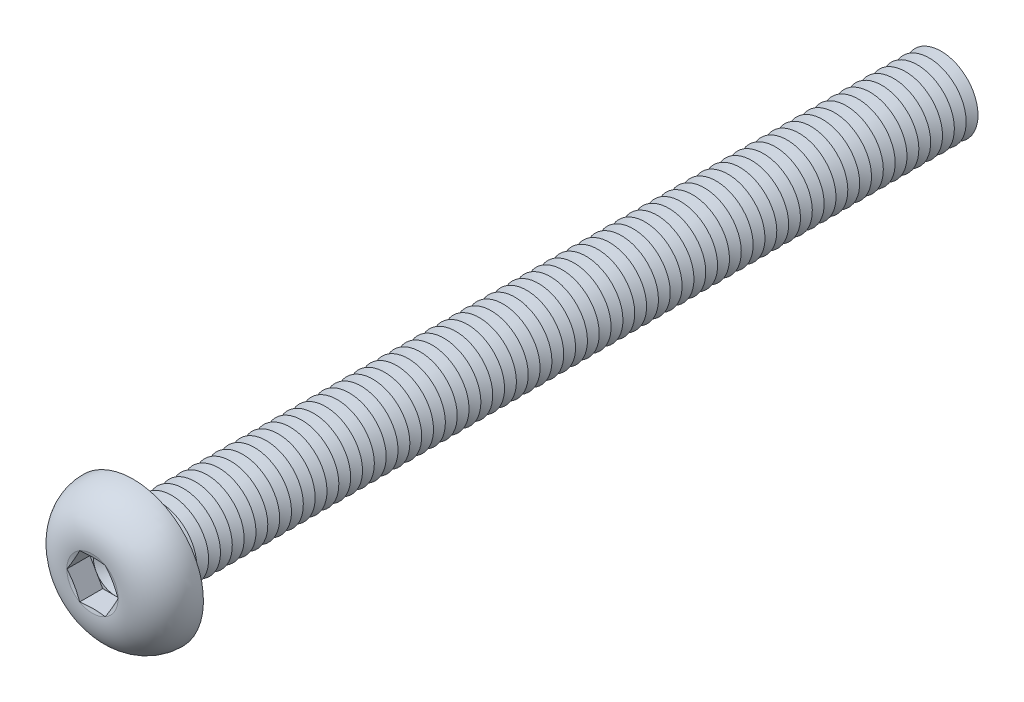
SolidWorks part; units mm, degrees
ref_plane "Front Plane" through (0, 0, 0) normal (0, 0, 1) x (1, 0, 0)
ref_plane "Top Plane" through (0, 0, 0) normal (0, 1, 0) x (1, 0, 0)
ref_plane "Right Plane" through (0, 0, 0) normal (1, 0, 0) x (0, 0, -1)
sketch "Sketch1" plane through (0, 0, 0) normal (1, 0, 0) x (0, 0, -1)
  line L0 (0, 2.5) -> (0, 4.75)
  line L3 (0, 2.5) -> (55, 2.5)
  line L4 (55, 2.5) -> (55, 0)
  line L5 (55, 0) -> (-2.75, 0) construction
  line L6 (-2.75, 0) -> (55, 0)
  line L7 (-2.75, 1.732) -> (-2.75, 0.866) construction
  line L8 (-2.75, 0.866) -> (-2.75, 0)
  line L9 (-2.75, 1.732) -> (-2.5179, 0.866)
  line L10 (-2.5179, 0.866) -> (-2.75, 0.866)
  line L11 (55, 0) -> (22.7481, 0) construction
  line L12 (0, 4.75) -> (-2.75, 4.75) construction
  arc A1 (0, 4.75) -> (-2.75, 1.732) centre (0, 1.9881) ccw
  point P8 (55, 1.25)
  dimension "D1" = 9.5
  dimension "D2" = 5
  dimension "D3" = 2.75
  dimension "D4" = 3.4641
  dimension "D5" = 55
  dimension "D6" = 15
revolve "Revolve1" add sketch "Sketch1" angle 360 about L5
fillet "Fillet1" radius 0.4 1 edges at (0, 2.5, 0)
sketch "Sketch2" plane through (0, 0, 0) normal (1, 0, 0) x (0, 0, -1)
  line L0 (54.6, 2.5) -> (55.4, 2.5)
  line L1 (55, 2.5) -> (0.4, 2.5) construction
  line L2 (55.4, 2.5) -> (55, 1.8072)
  line L3 (55, -2.5) -> (55, 2.5) construction
  line L4 (55, 1.8072) -> (54.6, 2.5)
  dimension "D1" = 0.8
revolve "Cut-Revolve1" cut sketch "Sketch2" angle 360 about axis through (0, 0, -55) along (0, 0, -1)
pattern_linear "LPattern1" count 68 spacing 0.8 along (0, 0, 1) of "Cut-Revolve1"
sketch "Sketch3" plane through (0, 0, 2.75) normal (0, 0, 1) x (1, 0, 0)
  line L7 (0.866, 1.5) -> (-0.866, 1.5)
  line L8 (-0.866, 1.5) -> (-1.7321, 0)
  line L9 (-1.7321, 0) -> (-0.866, -1.5)
  line L10 (-0.866, -1.5) -> (0.866, -1.5)
  line L11 (0.866, -1.5) -> (1.7321, 0)
  line L12 (1.7321, 0) -> (0.866, 1.5)
  circle A0 centre (0, 0) radius 1.5 construction
  circle A3 centre (0, 0) radius 1.732 construction
extrude "Cut-Extrude1" cut sketch "Sketch3" against normal blind 1.56
sketch "Sketch4" plane through (0, 0, 1.19) normal (0, 0, 1) x (1, 0, 0)
  line L1 (0.866, 1.5) -> (-0.866, 1.5) construction
  circle A0 centre (0, 0) radius 1.5
extrude "Cut-Extrude2" cut sketch "Sketch4" against normal through all draft 60
